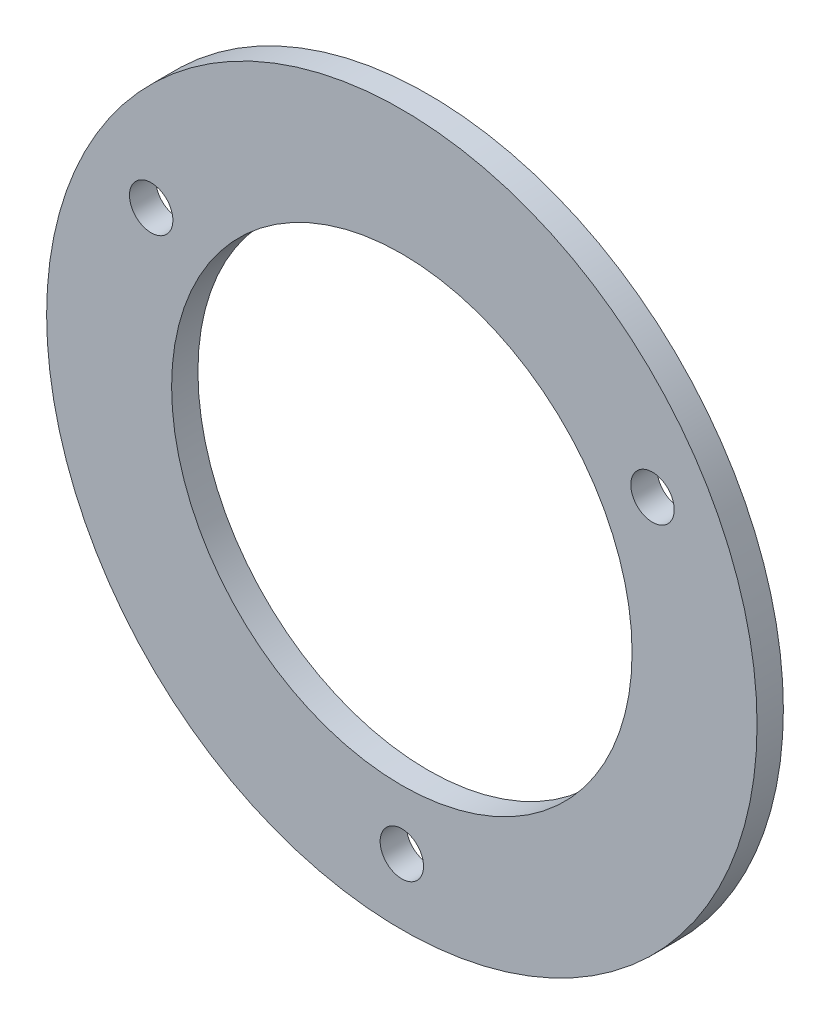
SolidWorks part; units mm, degrees
ref_plane "前视基准面" through (0, 0, 0) normal (0, 0, 1) x (1, 0, 0)
ref_plane "上视基准面" through (0, 0, 0) normal (0, 1, 0) x (1, 0, 0)
ref_plane "右视基准面" through (0, 0, 0) normal (1, 0, 0) x (0, 0, -1)
sketch "草图1" plane through (0, 0, 0) normal (0, 0, 1) x (1, 0, 0)
  circle A0 centre (25, 92) radius 27
  circle A1 centre (25, 92) radius 17.5
extrude "拉伸1" add sketch "草图1" along normal blind 2
hole_wizard "M4 螺纹孔1" positions "草图3" profile "草图2" tap size "M4" standard "ISO"
sketch "草图3" plane through (0, 0, 2) normal (0, 0, 1) x (1, 0, 0)
  point P1 (5.9474, 103)
  point P4 (25, 70)
  point P7 (44.0526, 103)
sketch "草图2" plane through (5.9474, 103, 2) normal (1, 0, 0) x (0, -1, 0)
  line L0 (0, 0) -> (0, 2)
  line L1 (0, 2) -> (1.65, 2)
  line L2 (1.65, 2) -> (1.65, 0)
  line L5 (1.65, 0) -> (0, 0)
  line L11 (0, -6.35) -> (0, 107.95) construction
  dimension "籵謂蹟恇謂郰芛眻噤" = 3.3
  dimension "籵謂蹟恇謂郰芛旮僅" = 2
